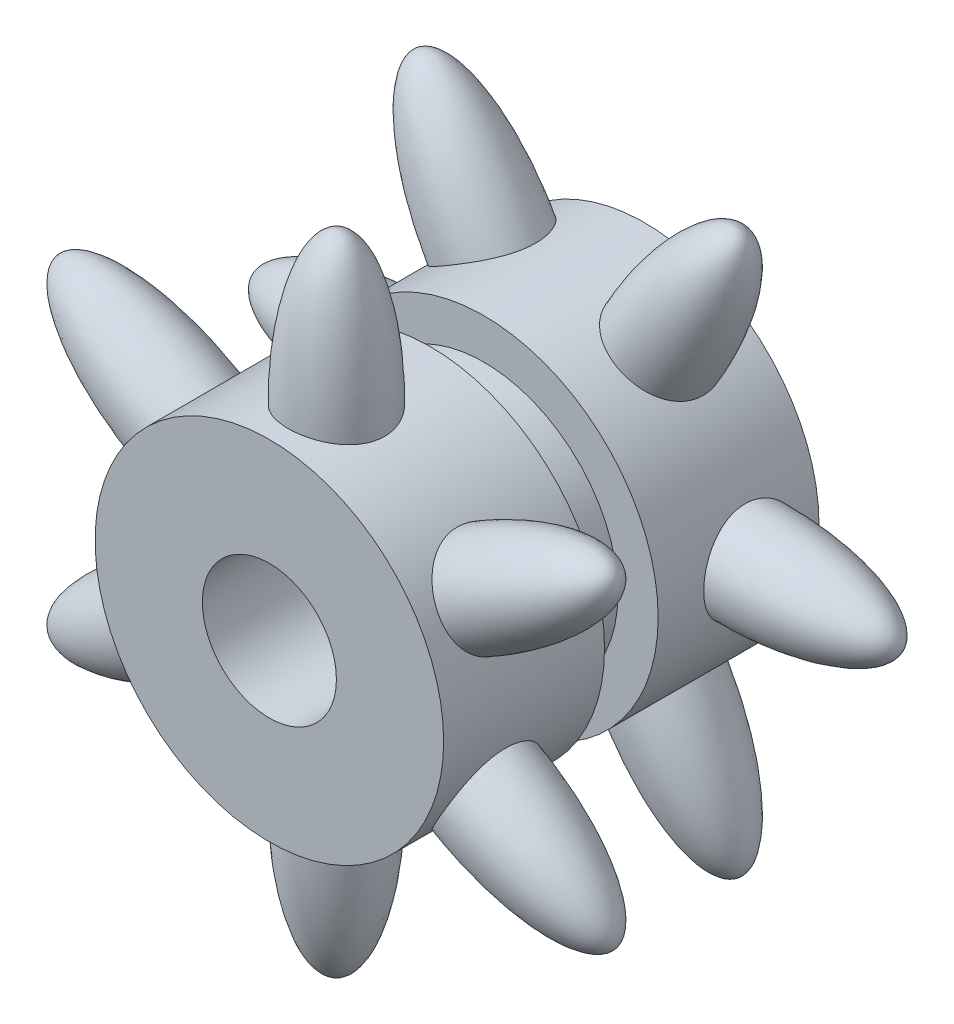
SolidWorks part; units mm, degrees
ref_plane "前视基准面" through (0, 0, 0) normal (0, 0, 1) x (1, 0, 0)
ref_plane "上视基准面" through (0, 0, 0) normal (0, 1, 0) x (1, 0, 0)
ref_plane "右视基准面" through (0, 0, 0) normal (1, 0, 0) x (0, 0, -1)
sketch "草图1" plane through (0, 0, 0) normal (0, 0, 1) x (1, 0, 0)
  circle A0 centre (0, 0) radius 1.25
  circle A1 centre (0, 0) radius 3.25
  dimension "D1" = 2.5
  dimension "D2" = 6.5
extrude "凸台-拉伸1" add sketch "草图1" along normal mid plane 7
sketch "草图2" plane through (0, 0, 0) normal (0, 0, 1) x (1, 0, 0)
  circle A0 centre (0, 0) radius 2.5
  circle A1 centre (0, 0) radius 3.25
  dimension "D1" = 6.5
  dimension "D2" = 5
extrude "切除-拉伸1" cut sketch "草图2" against normal mid plane 1
ref_plane "基准面1" through (0, 0, 2.25) normal (0, 0, 1) x (1, 0, 0)
sketch "草图3" plane through (0, 0, 2.25) normal (0, 0, 1) x (1, 0, 0)
  line L0 (0, 6) -> (0, 0.5)
  circle A0 centre (0, 0) radius 3.25 construction
  ellipse E0 centre (0, 3.25) end of major axis (0, 6) minor radius 0.9 (0, 6) -> (0, 0.5) ccw
  dimension "D1" = 5.5
  dimension "D2" = 1.8
revolve "旋转1" add sketch "草图3" angle 360 about L0
ref_plane "基准面2" through (0, 0, -2.25) normal (0, 0, -1) x (-1, 0, 0)
sketch "草图4" plane through (0, 0, -2.25) normal (0, 0, -1) x (-1, 0, 0)
  line L0 (0, 0) -> (-1.625, 2.8146) construction
  line L1 (0, 0) -> (0, 3.25) construction
  line L2 (-3, 5.1962) -> (-0.25, 0.433)
  circle A0 centre (0, 0) radius 3.25 construction
  ellipse E0 centre (-1.625, 2.8146) end of major axis (-3, 5.1962) minor radius 0.9 (-3, 5.1962) -> (-0.25, 0.433) ccw
  dimension "D1" = 30
  dimension "D2" = 5.5
  dimension "D3" = 1.8
revolve "旋转2" add sketch "草图4" angle 360 about L2
pattern_circular "阵列(圆周)4" count 6 over 360 about axis through (0, 0, 3.5) along (0, 0, 1) of "旋转1", "旋转2"
sketch "草图6" plane through (0, 0, -3.5) normal (0, 0, -1) x (-1, 0, 0)
  circle A0 centre (0, 0) radius 1.25
  dimension "D1" = 2.5
extrude "切除-拉伸3" cut sketch "草图6" against normal through all
